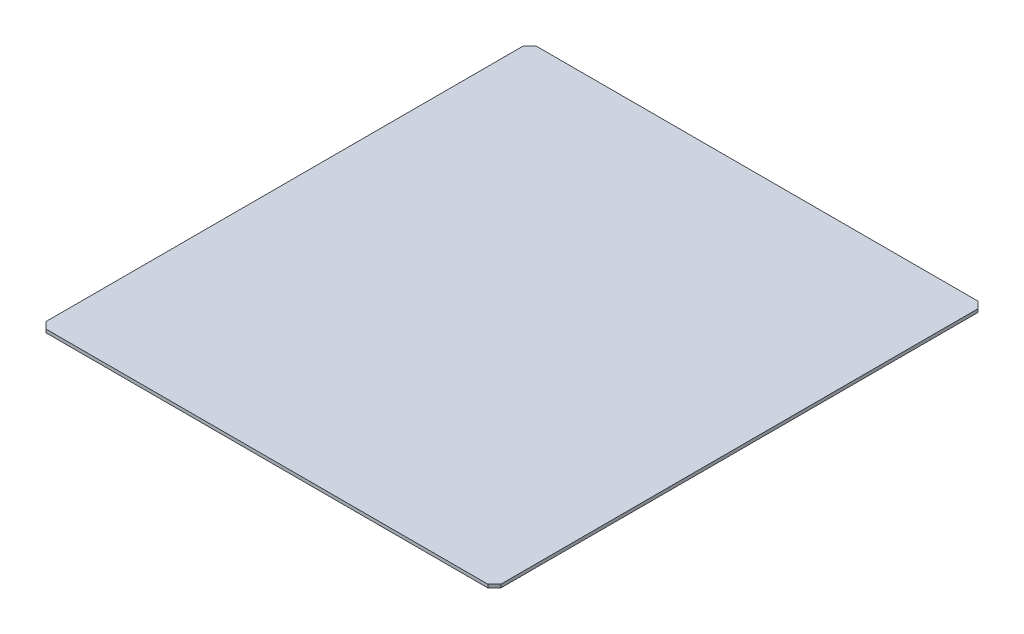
SolidWorks part; units mm, degrees
ref_plane "Plan1" through (0, 0, 0) normal (0, 0, 1) x (1, 0, 0)
ref_plane "Plan2" through (0, 0, 0) normal (0, 1, 0) x (1, 0, 0)
ref_plane "Plan3" through (0, 0, 0) normal (1, 0, 0) x (0, 0, -1)
sketch "Esquisse2" plane through (0, 0, 0) normal (0, 0, 1) x (1, 0, 0)
  line L0 (-60, -50) -> (-60, 50)
  line L1 (-60, 50) -> (60, 50)
  line L2 (60, 50) -> (60, -50)
  dimension "D1" = 120
  dimension "D2" = 100
  dimension "D3" = 60
  dimension "D4" = 50
extrude "Base-Extru.-Mince" add sketch "Esquisse2" along normal blind 100 thin
sketch "Esquisse3" plane through (64, 0, 0) normal (1, 0, 0) x (0, 0, -1)
  line L0 (-100, 54) -> (0, 54) construction
  line L1 (-100, 46) -> (-100, -50) construction
  circle A0 centre (-90, -4) radius 4.5
  circle A1 centre (-10, -4) radius 4.5
  dimension "D1" = 9
  dimension "D2" = 58
  dimension "D3" = 80
  dimension "D4" = 10
extrude "Enlèv. mat.-Extru.1" cut sketch "Esquisse3" against normal through all
sketch "Esquisse4" plane through (0, 54, 0) normal (0, 1, 0) x (-1, 0, 0)
  line L0 (-348, 10) -> (-338, 0)
  line L1 (-338, 0) -> (338, 0)
  line L2 (-348, 10) -> (-348, 740)
  line L3 (-338, 750) -> (338, 750)
  line L4 (348, 10) -> (348, 740)
  line L5 (-348, 740) -> (-338, 750)
  line L6 (338, 750) -> (348, 740)
  line L7 (338, 0) -> (348, 10)
  point P0 (-348, 0)
  point P1 (348, 750)
  point P2 (-348, 750)
  point P3 (348, 0)
  dimension "D1" = 696
  dimension "D2" = 750
  dimension "D3" = 348
extrude "Boss.-Extru.1" add sketch "Esquisse4" along normal blind 5
